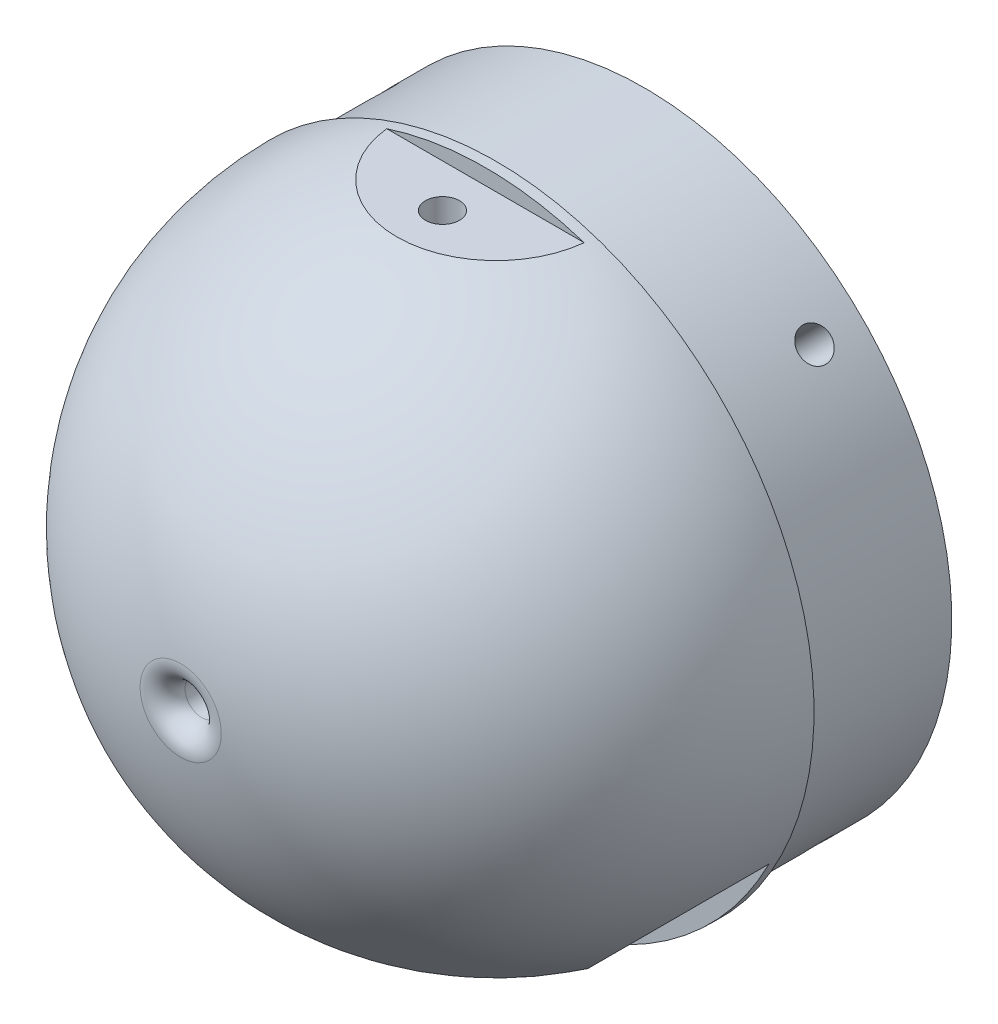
SolidWorks part; units mm, degrees
ref_plane "Front" through (0, 0, 0) normal (0, 0, 1) x (1, 0, 0)
ref_plane "Top" through (0, 0, 0) normal (0, 1, 0) x (1, 0, 0)
ref_plane "Right" through (0, 0, 0) normal (1, 0, 0) x (0, 0, -1)
sketch "Sketch1" plane through (0, 0, 0) normal (0, 0, 1) x (1, 0, 0)
  circle A0 centre (0, 0) radius 1.5
  circle A1 centre (0, 0) radius 47.625
  dimension "D1" = 3
  dimension "D2" = 95.25
extrude "Boss-Extrude1" add sketch "Sketch1" along normal mid plane 65
sketch "Sketch4" plane through (0, 0, 0) normal (1, 0, 0) x (0, 0, -1)
  line L0 (32.5, 47.625) -> (-32.5, 47.625) construction
  line L1 (-32.5, 47.625) -> (-32.5, -47.625) construction
  line L3 (-53.3071, 0) -> (-32.5, 0)
  line L5 (15.125, 47.625) -> (15.125, 65.1031)
  line L6 (15.125, 65.1031) -> (-53.3071, 65.1031)
  line L7 (-53.3071, 65.1031) -> (-53.3071, 0)
  arc A0 (15.125, 47.625) -> (-32.5, 0) centre (15.125, 0) ccw
  dimension "D1" = 47.625
revolve "Cut-Revolve1" cut sketch "Sketch4" angle 360 about L3
sketch "Sketch6" plane through (0, 0, 0) normal (1, 0, 0) x (0, 0, -1)
  line L0 (0, 0) -> (1422.5, 0) construction
  line L1 (-77.5, 20) -> (-77.5, -20) construction
  line L2 (0, 0) -> (-77.5, 0) construction
  line L3 (12.5, 4) -> (12.5, 2.5)
  line L4 (1422.5, 20) -> (1422.5, -20) construction
  line L5 (32.5, -47.625) -> (32.5, 47.625) construction
  line L6 (12.5, 4) -> (32.5, 4)
  line L7 (32.5, 4) -> (32.5, 0)
  line L8 (12.5, 2.5) -> (-32.4764, 2.5)
  line L9 (-32.4764, 0) -> (32.5, 0)
  line L10 (-32.4764, 2.5) -> (-32.4764, 0)
  line L11 (1422.5, -20) -> (-77.5, 2.8723) construction
  line L14 (-32.4764, -1.5) -> (-32.4764, 1.5) construction
  point P15 (-32.4764, 2.1858)
  point P19 (12.5, 1.5)
  dimension "D1" = 40
  dimension "D2" = 20
  dimension "D3" = 8
  dimension "D4" = 5
  dimension "D5" = 90
  dimension "D6" = 1500
  dimension "D7" = 3
  dimension "D8" = 4.3716
revolve "Cut-Revolve2" cut sketch "Sketch6" angle 360 about L9
sketch "Sketch10" plane through (0, 0, 0) normal (1, 0, 0) x (0, 0, -1)
  line L0 (37.35, 47.625) -> (37.35, 49.2125)
  line L1 (37.35, 49.2125) -> (19.8011, 49.2125)
  line L2 (19.8011, 49.2125) -> (19.8011, 50.8)
  line L3 (19.8011, 50.8) -> (15.125, 50.8)
  line L4 (15.125, 50.8) -> (15.125, 47.625)
  line L5 (15.125, 47.625) -> (37.35, 47.625)
  line L6 (0, 0) -> (41.9062, 0) construction
  dimension "D1" = 98.425
  dimension "D2" = 101.6
  dimension "D3" = 17.5489
  dimension "D4" = 22.225
revolve "Revolve1" add sketch "Sketch10" angle 360 about L6
fillet "Fillet3" radius 3.175 1 edges at (0, 2.5, 32.4343)
ref_plane "TARGET" through (0, 0, 75) normal (0, 0, 1) x (1, 0, 0)
ref_plane "Plane2" through (0, 47.625, 0) normal (0, 1, 0) x (-1, 0, 0)
sketch "Sketch22" plane through (0, 0, 0) normal (1, 0, 0) x (0, 0, -1)
  line L0 (37.35, -49.2125) -> (37.35, 49.2125) construction
  line L1 (-11.8625, 51.5938) -> (13.5375, 51.5938)
  line L2 (-11.8625, 51.5938) -> (-11.8625, 45.2437)
  line L3 (-11.8625, 45.2437) -> (13.5375, 45.2437)
  line L4 (13.5375, 51.5938) -> (13.5375, 45.2437)
  dimension "D1" = 23.8125
  dimension "D2" = 2.3813
  dimension "D3" = 25.4
  dimension "D4" = 6.35
extrude "Cut-Extrude6" cut sketch "Sketch22" against normal mid plane 50.8
hole_wizard "1/4-20 Tapped Hole1" positions "Sketch9" profile "Sketch8" tap size "1/4-20" standard "Ansi Inch"
sketch "Sketch9" plane through (6.0958, 45.2437, -0.6552) normal (0, 1, 0) x (-1, 0, 0)
  line L1 (-43.1167, -36.6948) -> (55.3083, -36.6948) construction
  point P1 (6.0958, -6.4459)
  dimension "D1" = 30.2489
sketch "Sketch8" plane through (0, 45.2437, -7.1011) normal (1, 0, 0) x (0, 0, 1)
  line L0 (0, 0) -> (0, 20.5838)
  line L1 (0, 20.5838) -> (2.5527, 19.05)
  line L2 (2.5527, 19.05) -> (2.5527, 0)
  line L5 (2.5527, 0) -> (0, 0)
  line L10 (0, 20.5838) -> (-2.5527, 19.05) construction
  line L11 (0, -6.35) -> (0, 107.95) construction
  dimension "Tap Drill Dia." = 5.1054
  dimension "Tap Drill Depth" = 19.05
  dimension "Drill Angle" = 118
sketch "Sketch12" plane through (0, 0, -32.5) normal (0, 0, -1) x (-1, 0, 0)
  circle A0 centre (0, 0) radius 47.625 construction
  circle A1 centre (0, 0) radius 47.625
  circle A2 centre (0, 0) radius 4 construction
  circle A3 centre (0, 0) radius 4
extrude "Boss-Extrude3" add sketch "Sketch12" along normal up to surface (4.85 mm away)
sketch "Sketch20" plane through (0, 0, -37.35) normal (0, 0, -1) x (-1, 0, 0)
  circle A0 centre (0, 0) radius 46.0375
  circle A1 centre (0, 0) radius 49.2125 construction
  dimension "D1" = 3.175
extrude "Cut-Extrude4" cut sketch "Sketch20" against normal up to surface (22.225 mm away) flip side to cut
ref_plane "Plane3" through (32.5534, -32.5534, 0) normal (0.7071, -0.7071, 0) x (0, 0, -1)
hole_wizard "#10-32 Tapped Hole2" positions "Sketch14" profile "Sketch13" tap size "#10-32" standard "Ansi Inch"
sketch "Sketch14" plane through (32.5534, -32.5534, 0) normal (0.7071, -0.7071, 0) x (0, 0, -1)
  line L1 (15.125, -46.0375) -> (15.125, 46.0375) construction
  line L2 (37.35, -46.0375) -> (37.35, 46.0375) construction
  point P1 (30.2786, 0)
  dimension "D1" = 15.1536
  dimension "D2" = 7.0714
sketch "Sketch13" plane through (32.5534, -32.5534, -30.2786) normal (0, 0, 1) x (0.7071, 0.7071, 0)
  line L0 (0, 0) -> (0, 14.8277)
  line L1 (0, 14.8277) -> (2.0193, 13.6144)
  line L2 (2.0193, 13.6144) -> (2.0193, 9.652)
  line L3 (2.0193, 9.652) -> (2.413, 9.652)
  line L4 (2.413, 9.652) -> (2.413, 0)
  line L5 (2.413, 0) -> (0, 0)
  line L10 (0, 14.8277) -> (-2.0193, 13.6144) construction
  line L11 (0, -6.35) -> (0, 107.95) construction
  dimension "Tap Drill Dia." = 4.0386
  dimension "Tap Drill Depth" = 13.6144
  dimension "Thread Major Dia." = 4.826
  dimension "Thread Depth" = 9.652
  dimension "Drill Angle" = 118
pattern_circular "CirPattern1" count 4 over 360 about axis through (0, 0, 0) along (0, 0, 1) of "#10-32 Tapped Hole2"
sketch "Sketch15" plane through (0, 0, 0) normal (1, 0, 0) x (0, 0, -1)
  line L0 (-32.1103, 44.9352) -> (-32.1103, -44.7953)
ref_plane "Plane4" through (-32.5534, -32.5534, 0) normal (-0.7071, -0.7071, 0) x (0, 0, -1)
ref_plane "Plane5" through (32.5534, -32.5534, 0) normal (0.7071, -0.7071, 0) x (0, 0, -1)
sketch "Sketch19" plane through (-32.5534, -32.5534, 0) normal (0.7071, 0.7071, 0) x (0, 0, -1)
  line L0 (5.6, -45.2374) -> (5.6, -53.1749) construction
  line L1 (13.5375, -45.2374) -> (-2.3375, -45.2374)
  line L2 (13.5375, -45.2374) -> (13.5375, -53.1749)
  line L3 (13.5375, -53.1749) -> (-2.3375, -53.1749)
  line L4 (-2.3375, -45.2374) -> (-2.3375, -53.1749)
  line L7 (37.35, -46.0375) -> (37.35, 46.0375) construction
  dimension "D1" = 23.8125
  dimension "D2" = 15.875
  dimension "D3" = 2.3876
  dimension "D4" = 7.9375
extrude "Cut-Extrude3" cut sketch "Sketch19" along normal through all
hole_wizard "#10-32 Tapped Hole3" positions "Sketch17" profile "Sketch16" tap size "#10-32" standard "Ansi Inch"
sketch "Sketch17" plane through (31.1967, -32.7786, -1.0083) normal (-0.7071, 0.7071, 0) x (0, 0, -1)
  line L2 (36.3417, -47.156) -> (36.3417, 44.919) construction
  point P0 (6.0928, -1.1185)
  dimension "D1" = 30.2489
sketch "Sketch16" plane through (31.9877, -31.9877, -7.1011) normal (0, 0, 1) x (0.7071, 0.7071, 0)
  line L0 (0, 0) -> (0, 14.8277)
  line L1 (0, 14.8277) -> (2.0193, 13.6144)
  line L2 (2.0193, 13.6144) -> (2.0193, 9.652)
  line L3 (2.0193, 9.652) -> (2.413, 9.652)
  line L4 (2.413, 9.652) -> (2.413, 0)
  line L5 (2.413, 0) -> (0, 0)
  line L10 (0, 14.8277) -> (-2.0193, 13.6144) construction
  line L11 (0, -6.35) -> (0, 107.95) construction
  dimension "Tap Drill Dia." = 4.0386
  dimension "Tap Drill Depth" = 13.6144
  dimension "Thread Major Dia." = 4.826
  dimension "Thread Depth" = 9.652
  dimension "Drill Angle" = 118
pattern_circular "CirPattern2" count 2 every 270 of "Cut-Extrude3", "#10-32 Tapped Hole3"
sketch "Sketch24" plane through (0, 0, 0) normal (1, 0, 0) x (0, 0, -1)
  point P0 (-32.5, 0)
